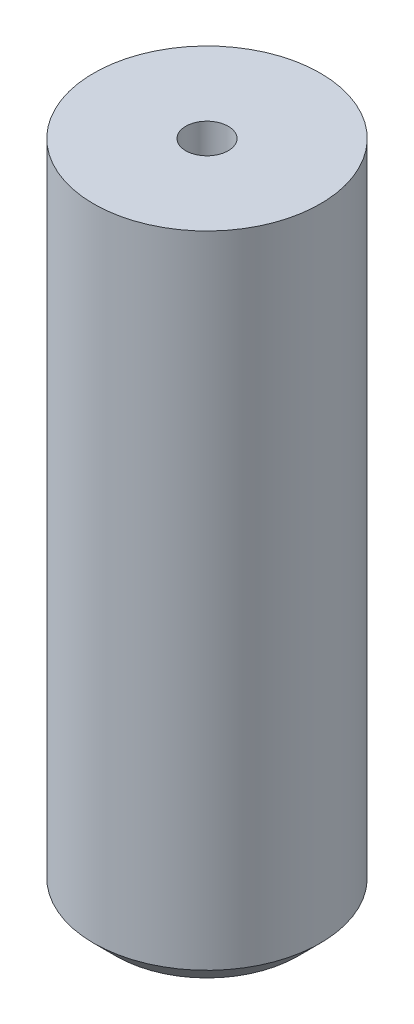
SolidWorks part; units mm, degrees
ref_plane "Front Plane" through (0, 0, 0) normal (0, 0, 1) x (1, 0, 0)
ref_plane "Top Plane" through (0, 0, 0) normal (0, 1, 0) x (1, 0, 0)
ref_plane "Right Plane" through (0, 0, 0) normal (1, 0, 0) x (0, 0, -1)
sketch "Sketch1" plane through (0, 0, 0) normal (0, 0, 1) x (1, 0, 0)
  line L0 (0, 0) -> (0, 74.0405) construction
  line L1 (0, -55) -> (0, 55) construction
  line L2 (0, 0) -> (2, 0)
  line L3 (2, 0) -> (2, -11.3)
  line L4 (1.6, -11.7) -> (1, -11.7)
  line L6 (1, -11.7) -> (1, -8.7)
  line L7 (1, -8.7) -> (0, -8.7)
  line L8 (0, -8.7) -> (0, 0)
  line L9 (2, -11.3) -> (1.6, -11.7)
  point P5 (2, -11.7)
  dimension "D1" = 2
  dimension "D2" = 4
  dimension "D3" = 3
  dimension "D4" = 11.7
revolve "Revolve1" add sketch "Sketch1" angle 360 about L0
hole_wizard "Ø0.75 (0.75) Diameter Hole1" positions "Sketch3" profile "Sketch2" hole size "Ø0.75" standard "ANSI Metric"
sketch "Sketch3" plane through (0, 0, 0) normal (0, 1, 0) x (1, 0, 0)
  point P0 (0, 0)
sketch "Sketch2" plane through (0, 0, 0) normal (1, 0, 0) x (0, 0, 1)
  line L0 (0, 0) -> (0, 11.7)
  line L1 (0, 11.7) -> (0.375, 11.7)
  line L2 (0.375, 11.7) -> (0.375, 0)
  line L5 (0.375, 0) -> (0, 0)
  line L11 (0, -6.35) -> (0, 107.95) construction
  dimension "Thru Hole Dia." = 0.75
  dimension "Thru Hole Depth" = 11.7
